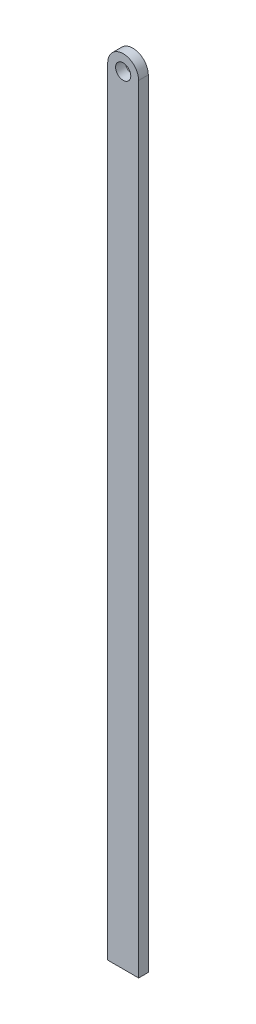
SolidWorks part; units mm, degrees
ref_plane "Front Plane" through (0, 0, 0) normal (0, 0, 1) x (1, 0, 0)
ref_plane "Top Plane" through (0, 0, 0) normal (0, 1, 0) x (1, 0, 0)
ref_plane "Right Plane" through (0, 0, 0) normal (1, 0, 0) x (0, 0, -1)
sketch "Sketch1" plane through (0, 0, 0) normal (0, 0, 1) x (1, 0, 0)
  line L0 (-13.2295, 0) -> (-13.2295, -61.3385)
  line L1 (-13.2295, -61.3385) -> (-15.6705, -61.3385)
  line L2 (-15.6705, -61.3385) -> (-15.6705, 0)
  circle A0 centre (-14.45, 0) radius 0.6 construction
  circle A1 centre (-14.45, 0) radius 0.6
  arc A3 (-13.2295, 0) -> (-15.6705, 0) centre (-14.45, 0) ccw
extrude "Boss-Extrude1" add sketch "Sketch1" along normal blind 0.762
